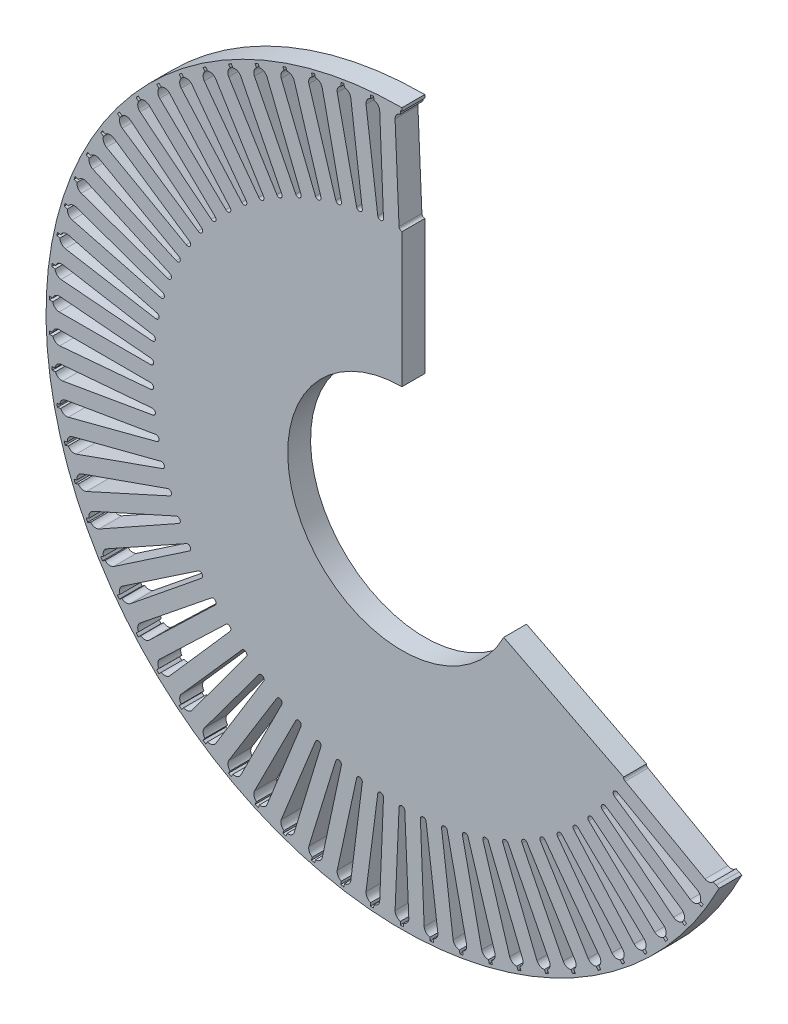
SolidWorks part; units mm, degrees
ref_plane "Přední rovina" through (0, 0, 0) normal (0, 0, 1) x (1, 0, 0)
ref_plane "Horní rovina" through (0, 0, 0) normal (0, 1, 0) x (1, 0, 0)
ref_plane "Pravá rovina" through (0, 0, 0) normal (1, 0, 0) x (0, 0, -1)
sketch "Skica2" plane through (0, 0, 0) normal (0, 0, 1) x (1, 0, 0)
  circle A0 centre (0, 0) radius 25
  circle A1 centre (0, 0) radius 77.9
extrude "Přidat vysunutím1" add sketch "Skica2" along normal blind 5
sketch "Skica1" plane through (0, 0, 0) normal (0, 0, 1) x (1, 0, 0)
  line L0 (0, 94.0554) -> (0, -97.5291) construction
  line L1 (-111.4898, 0) -> (131.9321, 0) construction
  line L2 (0, 77.9) -> (0, 77.2)
  line L3 (-0.35, 77.2) -> (0.35, 77.2)
  line L4 (0.35, 77.2) -> (0.35, 76.5)
  line L5 (0, 76.5) -> (0, 75.0365)
  line L6 (0, 75.0365) -> (0, 55.0346)
  line L7 (1.5047, 75.0365) -> (0.63, 55.0346)
  line L8 (-1.5047, 75.0365) -> (-0.63, 55.0346)
  line L9 (-0.35, 77.2) -> (-0.35, 76.5)
  line L10 (4.8642, 74.8938) -> (4.0395, 54.8898)
  line L11 (7.8629, 74.6386) -> (5.295, 54.7829)
  line L12 (6.8958, 76.8922) -> (6.8364, 76.1947)
  line L13 (6.1983, 76.9516) -> (6.1389, 76.2541)
  line L14 (6.1983, 76.9516) -> (6.8958, 76.8922)
  line L15 (11.1981, 74.2115) -> (8.68, 54.3495)
  line L16 (14.1643, 73.7029) -> (9.9218, 54.1365)
  line L17 (13.3918, 76.0304) -> (13.2735, 75.3405)
  line L18 (12.7019, 76.1487) -> (12.5836, 75.4588)
  line L19 (12.7019, 76.1487) -> (13.3918, 76.0304)
  line L20 (17.4514, 72.9945) -> (13.2578, 53.4176)
  line L21 (20.3637, 72.2362) -> (14.4772, 53.1001)
  line L22 (19.7914, 74.6208) -> (19.615, 73.9434)
  line L23 (19.114, 74.7972) -> (18.9376, 74.1198)
  line L24 (19.114, 74.7972) -> (19.7914, 74.6208)
  line L25 (23.5789, 71.2515) -> (17.7402, 52.1008)
  line L26 (26.4164, 70.249) -> (18.9282, 51.681)
  line L27 (26.0484, 72.6735) -> (25.8152, 72.0135)
  line L28 (25.3884, 72.9067) -> (25.1552, 72.2467)
  line L29 (25.3884, 72.9067) -> (26.0484, 72.6735)
  line L30 (29.5365, 68.9952) -> (22.0948, 50.4086)
  line L31 (32.2788, 67.7556) -> (23.2429, 49.8896)
  line L32 (32.1177, 70.2027) -> (31.8294, 69.5648)
  line L33 (31.4798, 70.491) -> (31.1915, 69.8531)
  line L34 (31.4798, 70.491) -> (32.1177, 70.2027)
  line L35 (35.2813, 66.2418) -> (26.2901, 48.3533)
  line L36 (37.9086, 64.7741) -> (27.3901, 47.7388)
  line L37 (37.9556, 67.226) -> (37.6142, 66.6149)
  line L38 (37.3445, 67.5674) -> (37.0031, 66.9563)
  line L39 (37.3445, 67.5674) -> (37.9556, 67.226)
  line L40 (40.7719, 63.0111) -> (30.296, 45.9495)
  line L41 (43.2653, 61.3259) -> (31.34, 45.2439)
  line L42 (43.52, 63.765) -> (43.128, 63.185)
  line L43 (42.9401, 64.1569) -> (42.5481, 63.577)
  line L44 (42.9401, 64.1569) -> (43.52, 63.765)
  line L45 (45.9687, 59.3264) -> (34.0837, 43.2147)
  line L46 (48.3102, 57.4358) -> (35.064, 42.4231)
  line L47 (48.7709, 59.8445) -> (48.3311, 59.2999)
  line L48 (48.2263, 60.2842) -> (47.7865, 59.7396)
  line L49 (48.2263, 60.2842) -> (48.7709, 59.8445)
  line L50 (50.8343, 55.2143) -> (37.6258, 40.1685)
  line L51 (53.007, 53.1319) -> (38.5354, 39.2967)
  line L52 (53.6704, 55.4928) -> (53.186, 54.9875)
  line L53 (53.165, 55.9772) -> (52.6806, 55.4718)
  line L54 (53.165, 55.9772) -> (53.6704, 55.4928)
  line L55 (55.3337, 50.7043) -> (40.8967, 36.8329)
  line L56 (57.322, 48.4452) -> (41.7292, 35.8871)
  line L57 (58.1831, 50.7414) -> (57.6577, 50.2789)
  line L58 (57.7207, 51.2668) -> (57.1952, 50.8044)
  line L59 (57.7207, 51.2668) -> (58.1831, 50.7414)
  line L60 (59.4344, 45.829) -> (43.8731, 33.2319)
  line L61 (61.2239, 43.4094) -> (44.6223, 32.2189)
  line L62 (62.2767, 45.6243) -> (61.7139, 45.208)
  line L63 (61.8605, 46.1871) -> (61.2977, 45.7708)
  line L64 (61.8605, 46.1871) -> (62.2767, 45.6243)
  line L65 (63.1068, 40.6235) -> (46.5333, 29.3915)
  line L66 (64.6847, 38.0609) -> (47.1939, 28.3186)
  line L67 (65.9216, 40.1785) -> (65.3255, 39.8115)
  line L68 (65.5545, 40.7746) -> (64.9585, 40.4075)
  line L69 (65.5545, 40.7746) -> (65.9216, 40.1785)
  line L70 (66.3246, 35.1253) -> (48.8582, 25.3393)
  line L71 (67.6795, 32.4381) -> (49.4255, 24.2143)
  line L72 (69.0914, 34.4432) -> (68.4664, 34.1281)
  line L73 (68.7763, 35.0683) -> (68.1513, 34.7531)
  line L74 (68.7763, 35.0683) -> (69.0914, 34.4432)
  line L75 (69.0645, 29.3741) -> (50.8311, 21.1046)
  line L76 (70.1866, 26.5816) -> (51.3009, 19.9354)
  line L77 (71.7635, 28.4598) -> (71.114, 28.1988)
  line L78 (71.5025, 29.1093) -> (70.853, 28.8483)
  line L79 (71.5025, 29.1093) -> (71.7635, 28.4598)
  line L80 (71.3068, 23.4112) -> (52.4378, 16.7178)
  line L81 (72.1881, 20.5336) -> (52.8068, 15.513)
  line L82 (73.9186, 22.2713) -> (73.2492, 22.0663)
  line L83 (73.7136, 22.9406) -> (73.0443, 22.7356)
  line L84 (73.7136, 22.9406) -> (73.9186, 22.2713)
  line L85 (73.0353, 17.2796) -> (53.6667, 12.2105)
  line L86 (73.6694, 14.3377) -> (53.9321, 10.9788)
  line L87 (75.541, 15.9223) -> (74.8567, 15.7748)
  line L88 (75.3935, 16.6066) -> (74.7092, 16.4591)
  line L89 (75.3935, 16.6066) -> (75.541, 15.9223)
  line L90 (74.2376, 11.0235) -> (54.5088, 7.6153)
  line L91 (74.6199, 8.0384) -> (54.6689, 6.3655)
  line L92 (76.6192, 9.4586) -> (75.9248, 9.3697)
  line L93 (76.5303, 10.1529) -> (75.8359, 10.064)
  line L94 (76.5303, 10.1529) -> (76.6192, 9.4586)
  line L95 (74.9051, 4.688) -> (54.9583, 2.9652)
  line L96 (75.0328, 1.6813) -> (55.0118, 1.7063)
  line L97 (77.1453, 2.9268) -> (76.4459, 2.8971)
  line L98 (77.1156, 3.6261) -> (76.4162, 3.5964)
  line L99 (77.1156, 3.6261) -> (77.1453, 2.9268)
  line L100 (75.0328, -1.6813) -> (55.0118, -1.7063)
  line L101 (74.9051, -4.688) -> (54.9583, -2.9652)
  line L102 (77.1156, -3.6261) -> (76.4162, -3.5964)
  line L103 (77.1453, -2.9268) -> (76.4459, -2.8971)
  line L104 (77.1453, -2.9268) -> (77.1156, -3.6261)
  line L105 (74.6199, -8.0384) -> (54.6689, -6.3655)
  line L106 (74.2376, -11.0235) -> (54.5088, -7.6153)
  line L107 (76.5303, -10.1529) -> (75.8359, -10.064)
  line L108 (76.6192, -9.4586) -> (75.9248, -9.3697)
  line L109 (76.6192, -9.4586) -> (76.5303, -10.1529)
  line L110 (73.6694, -14.3377) -> (53.9321, -10.9788)
  line L111 (73.0353, -17.2796) -> (53.6667, -12.2105)
  line L112 (75.3935, -16.6066) -> (74.7092, -16.4591)
  line L113 (75.541, -15.9223) -> (74.8567, -15.7748)
  line L114 (75.541, -15.9223) -> (75.3935, -16.6066)
  line L115 (72.1881, -20.5336) -> (52.8068, -15.513)
  line L116 (71.3068, -23.4112) -> (52.4378, -16.7178)
  line L117 (73.7136, -22.9406) -> (73.0443, -22.7356)
  line L118 (73.9186, -22.2713) -> (73.2492, -22.0663)
  line L119 (73.9186, -22.2713) -> (73.7136, -22.9406)
  line L120 (70.1866, -26.5816) -> (51.3009, -19.9354)
  line L121 (69.0645, -29.3741) -> (50.8311, -21.1046)
  line L122 (71.5025, -29.1093) -> (70.853, -28.8483)
  line L123 (71.7635, -28.4598) -> (71.114, -28.1988)
  line L124 (71.7635, -28.4598) -> (71.5025, -29.1093)
  line L125 (67.6795, -32.4381) -> (49.4255, -24.2143)
  line L126 (66.3246, -35.1253) -> (48.8582, -25.3393)
  line L127 (68.7763, -35.0683) -> (68.1513, -34.7531)
  line L128 (69.0914, -34.4432) -> (68.4664, -34.1281)
  line L129 (69.0914, -34.4432) -> (68.7763, -35.0683)
  line L130 (64.6847, -38.0609) -> (47.1939, -28.3186)
  line L131 (63.1068, -40.6235) -> (46.5333, -29.3915)
  line L132 (65.5545, -40.7746) -> (64.9585, -40.4075)
  line L133 (65.9216, -40.1785) -> (65.3255, -39.8115)
  line L134 (65.9216, -40.1785) -> (65.5545, -40.7746)
  line L135 (61.2239, -43.4094) -> (44.6223, -32.2189)
  line L136 (59.4344, -45.829) -> (43.8731, -33.2319)
  line L137 (61.8605, -46.1871) -> (61.2977, -45.7708)
  line L138 (62.2767, -45.6243) -> (61.7139, -45.208)
  line L139 (62.2767, -45.6243) -> (61.8605, -46.1871)
  line L140 (57.322, -48.4452) -> (41.7292, -35.8871)
  line L141 (55.3337, -50.7043) -> (40.8967, -36.8329)
  line L142 (57.7207, -51.2668) -> (57.1952, -50.8044)
  line L143 (58.1831, -50.7414) -> (57.6577, -50.2789)
  line L144 (58.1831, -50.7414) -> (57.7207, -51.2668)
  line L145 (53.007, -53.1319) -> (38.5354, -39.2967)
  line L146 (50.8343, -55.2143) -> (37.6258, -40.1685)
  line L147 (53.165, -55.9772) -> (52.6806, -55.4718)
  line L148 (53.6704, -55.4928) -> (53.186, -54.9875)
  line L149 (53.6704, -55.4928) -> (53.165, -55.9772)
  line L150 (48.3102, -57.4358) -> (35.064, -42.4231)
  line L151 (45.9687, -59.3264) -> (34.0837, -43.2147)
  line L152 (48.2263, -60.2842) -> (47.7865, -59.7396)
  line L153 (48.7709, -59.8445) -> (48.3311, -59.2999)
  line L154 (48.7709, -59.8445) -> (48.2263, -60.2842)
  line L155 (43.2653, -61.3259) -> (31.34, -45.2439)
  line L156 (40.7719, -63.0111) -> (30.296, -45.9495)
  line L157 (42.9401, -64.1569) -> (42.5481, -63.577)
  line L158 (43.52, -63.765) -> (43.128, -63.185)
  line L159 (43.52, -63.765) -> (42.9401, -64.1569)
  line L160 (37.9086, -64.7741) -> (27.3901, -47.7388)
  line L161 (35.2813, -66.2418) -> (26.2901, -48.3533)
  line L162 (37.3445, -67.5674) -> (37.0031, -66.9563)
  line L163 (37.9556, -67.226) -> (37.6142, -66.6149)
  line L164 (37.9556, -67.226) -> (37.3445, -67.5674)
  line L165 (32.2788, -67.7556) -> (23.2429, -49.8896)
  line L166 (29.5365, -68.9952) -> (22.0948, -50.4086)
  line L167 (31.4798, -70.491) -> (31.1915, -69.8531)
  line L168 (32.1177, -70.2027) -> (31.8294, -69.5648)
  line L169 (32.1177, -70.2027) -> (31.4798, -70.491)
  line L170 (26.4164, -70.249) -> (18.9282, -51.681)
  line L171 (23.5789, -71.2515) -> (17.7402, -52.1008)
  line L172 (25.3884, -72.9067) -> (25.1552, -72.2467)
  line L173 (26.0484, -72.6735) -> (25.8152, -72.0135)
  line L174 (26.0484, -72.6735) -> (25.3884, -72.9067)
  line L175 (20.3637, -72.2362) -> (14.4772, -53.1001)
  line L176 (17.4514, -72.9945) -> (13.2578, -53.4176)
  line L177 (19.114, -74.7972) -> (18.9376, -74.1198)
  line L178 (19.7914, -74.6208) -> (19.615, -73.9434)
  line L179 (19.7914, -74.6208) -> (19.114, -74.7972)
  line L180 (14.1643, -73.7029) -> (9.9218, -54.1365)
  line L181 (11.1981, -74.2115) -> (8.68, -54.3495)
  line L182 (12.7019, -76.1487) -> (12.5836, -75.4588)
  line L183 (13.3918, -76.0304) -> (13.2735, -75.3405)
  line L184 (13.3918, -76.0304) -> (12.7019, -76.1487)
  line L185 (7.8629, -74.6386) -> (5.295, -54.7829)
  line L186 (4.8642, -74.8938) -> (4.0395, -54.8898)
  line L187 (6.1983, -76.9516) -> (6.1389, -76.2541)
  line L188 (6.8958, -76.8922) -> (6.8364, -76.1947)
  line L189 (6.8958, -76.8922) -> (6.1983, -76.9516)
  line L190 (1.5047, -75.0365) -> (0.63, -55.0346)
  line L191 (-1.5047, -75.0365) -> (-0.63, -55.0346)
  line L192 (-0.35, -77.2) -> (-0.35, -76.5)
  line L193 (0.35, -77.2) -> (0.35, -76.5)
  line L194 (0.35, -77.2) -> (-0.35, -77.2)
  line L195 (-4.8642, -74.8938) -> (-4.0395, -54.8898)
  line L196 (-7.8629, -74.6386) -> (-5.295, -54.7829)
  line L197 (-6.8958, -76.8922) -> (-6.8364, -76.1947)
  line L198 (-6.1983, -76.9516) -> (-6.1389, -76.2541)
  line L199 (-6.1983, -76.9516) -> (-6.8958, -76.8922)
  line L200 (-11.1981, -74.2115) -> (-8.68, -54.3495)
  line L201 (-14.1643, -73.7029) -> (-9.9218, -54.1365)
  line L202 (-13.3918, -76.0304) -> (-13.2735, -75.3405)
  line L203 (-12.7019, -76.1487) -> (-12.5836, -75.4588)
  line L204 (-12.7019, -76.1487) -> (-13.3918, -76.0304)
  line L205 (-17.4514, -72.9945) -> (-13.2578, -53.4176)
  line L206 (-20.3637, -72.2362) -> (-14.4772, -53.1001)
  line L207 (-19.7914, -74.6208) -> (-19.615, -73.9434)
  line L208 (-19.114, -74.7972) -> (-18.9376, -74.1198)
  line L209 (-19.114, -74.7972) -> (-19.7914, -74.6208)
  line L210 (-23.5789, -71.2515) -> (-17.7402, -52.1008)
  line L211 (-26.4164, -70.249) -> (-18.9282, -51.681)
  line L212 (-26.0484, -72.6735) -> (-25.8152, -72.0135)
  line L213 (-25.3884, -72.9067) -> (-25.1552, -72.2467)
  line L214 (-25.3884, -72.9067) -> (-26.0484, -72.6735)
  line L215 (-29.5365, -68.9952) -> (-22.0948, -50.4086)
  line L216 (-32.2788, -67.7556) -> (-23.2429, -49.8896)
  line L217 (-32.1177, -70.2027) -> (-31.8294, -69.5648)
  line L218 (-31.4798, -70.491) -> (-31.1915, -69.8531)
  line L219 (-31.4798, -70.491) -> (-32.1177, -70.2027)
  line L220 (-35.2813, -66.2418) -> (-26.2901, -48.3533)
  line L221 (-37.9086, -64.7741) -> (-27.3901, -47.7388)
  line L222 (-37.9556, -67.226) -> (-37.6142, -66.6149)
  line L223 (-37.3445, -67.5674) -> (-37.0031, -66.9563)
  line L224 (-37.3445, -67.5674) -> (-37.9556, -67.226)
  line L225 (-40.7719, -63.0111) -> (-30.296, -45.9495)
  line L226 (-43.2653, -61.3259) -> (-31.34, -45.2439)
  line L227 (-43.52, -63.765) -> (-43.128, -63.185)
  line L228 (-42.9401, -64.1569) -> (-42.5481, -63.577)
  line L229 (-42.9401, -64.1569) -> (-43.52, -63.765)
  line L230 (-45.9687, -59.3264) -> (-34.0837, -43.2147)
  line L231 (-48.3102, -57.4358) -> (-35.064, -42.4231)
  line L232 (-48.7709, -59.8445) -> (-48.3311, -59.2999)
  line L233 (-48.2263, -60.2842) -> (-47.7865, -59.7396)
  line L234 (-48.2263, -60.2842) -> (-48.7709, -59.8445)
  line L235 (-50.8343, -55.2143) -> (-37.6258, -40.1685)
  line L236 (-53.007, -53.1319) -> (-38.5354, -39.2967)
  line L237 (-53.6704, -55.4928) -> (-53.186, -54.9875)
  line L238 (-53.165, -55.9772) -> (-52.6806, -55.4718)
  line L239 (-53.165, -55.9772) -> (-53.6704, -55.4928)
  line L240 (-55.3337, -50.7043) -> (-40.8967, -36.8329)
  line L241 (-57.322, -48.4452) -> (-41.7292, -35.8871)
  line L242 (-58.1831, -50.7414) -> (-57.6577, -50.2789)
  line L243 (-57.7207, -51.2668) -> (-57.1952, -50.8044)
  line L244 (-57.7207, -51.2668) -> (-58.1831, -50.7414)
  line L245 (-59.4344, -45.829) -> (-43.8731, -33.2319)
  line L246 (-61.2239, -43.4094) -> (-44.6223, -32.2189)
  line L247 (-62.2767, -45.6243) -> (-61.7139, -45.208)
  line L248 (-61.8605, -46.1871) -> (-61.2977, -45.7708)
  line L249 (-61.8605, -46.1871) -> (-62.2767, -45.6243)
  line L250 (-63.1068, -40.6235) -> (-46.5333, -29.3915)
  line L251 (-64.6847, -38.0609) -> (-47.1939, -28.3186)
  line L252 (-65.9216, -40.1785) -> (-65.3255, -39.8115)
  line L253 (-65.5545, -40.7746) -> (-64.9585, -40.4075)
  line L254 (-65.5545, -40.7746) -> (-65.9216, -40.1785)
  line L255 (-66.3246, -35.1253) -> (-48.8582, -25.3393)
  line L256 (-67.6795, -32.4381) -> (-49.4255, -24.2143)
  line L257 (-69.0914, -34.4432) -> (-68.4664, -34.1281)
  line L258 (-68.7763, -35.0683) -> (-68.1513, -34.7531)
  line L259 (-68.7763, -35.0683) -> (-69.0914, -34.4432)
  line L260 (-69.0645, -29.3741) -> (-50.8311, -21.1046)
  line L261 (-70.1866, -26.5816) -> (-51.3009, -19.9354)
  line L262 (-71.7635, -28.4598) -> (-71.114, -28.1988)
  line L263 (-71.5025, -29.1093) -> (-70.853, -28.8483)
  line L264 (-71.5025, -29.1093) -> (-71.7635, -28.4598)
  line L265 (-71.3068, -23.4112) -> (-52.4378, -16.7178)
  line L266 (-72.1881, -20.5336) -> (-52.8068, -15.513)
  line L267 (-73.9186, -22.2713) -> (-73.2492, -22.0663)
  line L268 (-73.7136, -22.9406) -> (-73.0443, -22.7356)
  line L269 (-73.7136, -22.9406) -> (-73.9186, -22.2713)
  line L270 (-73.0353, -17.2796) -> (-53.6667, -12.2105)
  line L271 (-73.6694, -14.3377) -> (-53.9321, -10.9788)
  line L272 (-75.541, -15.9223) -> (-74.8567, -15.7748)
  line L273 (-75.3935, -16.6066) -> (-74.7092, -16.4591)
  line L274 (-75.3935, -16.6066) -> (-75.541, -15.9223)
  line L275 (-74.2376, -11.0235) -> (-54.5088, -7.6153)
  line L276 (-74.6199, -8.0384) -> (-54.6689, -6.3655)
  line L277 (-76.6192, -9.4586) -> (-75.9248, -9.3697)
  line L278 (-76.5303, -10.1529) -> (-75.8359, -10.064)
  line L279 (-76.5303, -10.1529) -> (-76.6192, -9.4586)
  line L280 (-74.9051, -4.688) -> (-54.9583, -2.9652)
  line L281 (-75.0328, -1.6813) -> (-55.0118, -1.7063)
  line L282 (-77.1453, -2.9268) -> (-76.4459, -2.8971)
  line L283 (-77.1156, -3.6261) -> (-76.4162, -3.5964)
  line L284 (-77.1156, -3.6261) -> (-77.1453, -2.9268)
  line L285 (-75.0328, 1.6813) -> (-55.0118, 1.7063)
  line L286 (-74.9051, 4.688) -> (-54.9583, 2.9652)
  line L287 (-77.1156, 3.6261) -> (-76.4162, 3.5964)
  line L288 (-77.1453, 2.9268) -> (-76.4459, 2.8971)
  line L289 (-77.1453, 2.9268) -> (-77.1156, 3.6261)
  line L290 (-74.6199, 8.0384) -> (-54.6689, 6.3655)
  line L291 (-74.2376, 11.0235) -> (-54.5088, 7.6153)
  line L292 (-76.5303, 10.1529) -> (-75.8359, 10.064)
  line L293 (-76.6192, 9.4586) -> (-75.9248, 9.3697)
  line L294 (-76.6192, 9.4586) -> (-76.5303, 10.1529)
  line L295 (-73.6694, 14.3377) -> (-53.9321, 10.9788)
  line L296 (-73.0353, 17.2796) -> (-53.6667, 12.2105)
  line L297 (-75.3935, 16.6066) -> (-74.7092, 16.4591)
  line L298 (-75.541, 15.9223) -> (-74.8567, 15.7748)
  line L299 (-75.541, 15.9223) -> (-75.3935, 16.6066)
  line L300 (-72.1881, 20.5336) -> (-52.8068, 15.513)
  line L301 (-71.3068, 23.4112) -> (-52.4378, 16.7178)
  line L302 (-73.7136, 22.9406) -> (-73.0443, 22.7356)
  line L303 (-73.9186, 22.2713) -> (-73.2492, 22.0663)
  line L304 (-73.9186, 22.2713) -> (-73.7136, 22.9406)
  line L305 (-70.1866, 26.5816) -> (-51.3009, 19.9354)
  line L306 (-69.0645, 29.3741) -> (-50.8311, 21.1046)
  line L307 (-71.5025, 29.1093) -> (-70.853, 28.8483)
  line L308 (-71.7635, 28.4598) -> (-71.114, 28.1988)
  line L309 (-71.7635, 28.4598) -> (-71.5025, 29.1093)
  line L310 (-67.6795, 32.4381) -> (-49.4255, 24.2143)
  line L311 (-66.3246, 35.1253) -> (-48.8582, 25.3393)
  line L312 (-68.7763, 35.0683) -> (-68.1513, 34.7531)
  line L313 (-69.0914, 34.4432) -> (-68.4664, 34.1281)
  line L314 (-69.0914, 34.4432) -> (-68.7763, 35.0683)
  line L315 (-64.6847, 38.0609) -> (-47.1939, 28.3186)
  line L316 (-63.1068, 40.6235) -> (-46.5333, 29.3915)
  line L317 (-65.5545, 40.7746) -> (-64.9585, 40.4075)
  line L318 (-65.9216, 40.1785) -> (-65.3255, 39.8115)
  line L319 (-65.9216, 40.1785) -> (-65.5545, 40.7746)
  line L320 (-61.2239, 43.4094) -> (-44.6223, 32.2189)
  line L321 (-59.4344, 45.829) -> (-43.8731, 33.2319)
  line L322 (-61.8605, 46.1871) -> (-61.2977, 45.7708)
  line L323 (-62.2767, 45.6243) -> (-61.7139, 45.208)
  line L324 (-62.2767, 45.6243) -> (-61.8605, 46.1871)
  line L325 (-57.322, 48.4452) -> (-41.7292, 35.8871)
  line L326 (-55.3337, 50.7043) -> (-40.8967, 36.8329)
  line L327 (-57.7207, 51.2668) -> (-57.1952, 50.8044)
  line L328 (-58.1831, 50.7414) -> (-57.6577, 50.2789)
  line L329 (-58.1831, 50.7414) -> (-57.7207, 51.2668)
  line L330 (-53.007, 53.1319) -> (-38.5354, 39.2967)
  line L331 (-50.8343, 55.2143) -> (-37.6258, 40.1685)
  line L332 (-53.165, 55.9772) -> (-52.6806, 55.4718)
  line L333 (-53.6704, 55.4928) -> (-53.186, 54.9875)
  line L334 (-53.6704, 55.4928) -> (-53.165, 55.9772)
  line L335 (-48.3102, 57.4358) -> (-35.064, 42.4231)
  line L336 (-45.9687, 59.3264) -> (-34.0837, 43.2147)
  line L337 (-48.2263, 60.2842) -> (-47.7865, 59.7396)
  line L338 (-48.7709, 59.8445) -> (-48.3311, 59.2999)
  line L339 (-48.7709, 59.8445) -> (-48.2263, 60.2842)
  line L340 (-43.2653, 61.3259) -> (-31.34, 45.2439)
  line L341 (-40.7719, 63.0111) -> (-30.296, 45.9495)
  line L342 (-42.9401, 64.1569) -> (-42.5481, 63.577)
  line L343 (-43.52, 63.765) -> (-43.128, 63.185)
  line L344 (-43.52, 63.765) -> (-42.9401, 64.1569)
  line L345 (-37.9086, 64.7741) -> (-27.3901, 47.7388)
  line L346 (-35.2813, 66.2418) -> (-26.2901, 48.3533)
  line L347 (-37.3445, 67.5674) -> (-37.0031, 66.9563)
  line L348 (-37.9556, 67.226) -> (-37.6142, 66.6149)
  line L349 (-37.9556, 67.226) -> (-37.3445, 67.5674)
  line L350 (-32.2788, 67.7556) -> (-23.2429, 49.8896)
  line L351 (-29.5365, 68.9952) -> (-22.0948, 50.4086)
  line L352 (-31.4798, 70.491) -> (-31.1915, 69.8531)
  line L353 (-32.1177, 70.2027) -> (-31.8294, 69.5648)
  line L354 (-32.1177, 70.2027) -> (-31.4798, 70.491)
  line L355 (-26.4164, 70.249) -> (-18.9282, 51.681)
  line L356 (-23.5789, 71.2515) -> (-17.7402, 52.1008)
  line L357 (-25.3884, 72.9067) -> (-25.1552, 72.2467)
  line L358 (-26.0484, 72.6735) -> (-25.8152, 72.0135)
  line L359 (-26.0484, 72.6735) -> (-25.3884, 72.9067)
  line L360 (-20.3637, 72.2362) -> (-14.4772, 53.1001)
  line L361 (-17.4514, 72.9945) -> (-13.2578, 53.4176)
  line L362 (-19.114, 74.7972) -> (-18.9376, 74.1198)
  line L363 (-19.7914, 74.6208) -> (-19.615, 73.9434)
  line L364 (-19.7914, 74.6208) -> (-19.114, 74.7972)
  line L365 (-14.1643, 73.7029) -> (-9.9218, 54.1365)
  line L366 (-11.1981, 74.2115) -> (-8.68, 54.3495)
  line L367 (-12.7019, 76.1487) -> (-12.5836, 75.4588)
  line L368 (-13.3918, 76.0304) -> (-13.2735, 75.3405)
  line L369 (-13.3918, 76.0304) -> (-12.7019, 76.1487)
  line L370 (-7.8629, 74.6386) -> (-5.295, 54.7829)
  line L371 (-4.8642, 74.8938) -> (-4.0395, 54.8898)
  line L372 (-6.1983, 76.9516) -> (-6.1389, 76.2541)
  line L373 (-6.8958, 76.8922) -> (-6.8364, 76.1947)
  line L374 (-6.8958, 76.8922) -> (-6.1983, 76.9516)
  circle A0 centre (0, 0) radius 25
  circle A1 centre (0, 0) radius 77.9
  arc A2 (1.499, 74.9052) -> (0.35, 76.5) centre (0, 75.0365) ccw
  arc A3 (-0.63, 55.0346) -> (0.63, 55.0346) centre (0, 55.0346) ccw
  arc A4 (-0.35, 76.5) -> (-1.499, 74.9052) centre (0, 75.0365) ccw
  arc A5 (4.0395, 54.8898) -> (5.295, 54.7829) centre (4.6673, 54.8364) ccw
  arc A6 (6.1389, 76.2541) -> (4.8588, 74.7624) centre (6.3635, 74.7662) ccw
  arc A7 (7.846, 74.5082) -> (6.8364, 76.1947) centre (6.3635, 74.7662) ccw
  arc A8 (8.68, 54.3495) -> (9.9218, 54.1365) centre (9.3009, 54.243) ccw
  arc A9 (12.5836, 75.4588) -> (11.1816, 74.0811) centre (12.6812, 73.9572) ccw
  arc A10 (14.1365, 73.5744) -> (13.2735, 75.3405) centre (12.6812, 73.9572) ccw
  arc A11 (13.2578, 53.4176) -> (14.4772, 53.1001) centre (13.8675, 53.2588) ccw
  arc A12 (18.9376, 74.1198) -> (17.4238, 72.8659) centre (18.9076, 72.6153) ccw
  arc A13 (20.3251, 72.1105) -> (19.615, 73.9434) centre (18.9076, 72.6153) ccw
  arc A14 (17.7402, 52.1008) -> (18.9282, 51.681) centre (18.3342, 51.8909) ccw
  arc A15 (25.1552, 72.2467) -> (23.5405, 71.1258) centre (24.9977, 70.7503) ccw
  arc A16 (26.3673, 70.127) -> (25.8152, 72.0135) centre (24.9977, 70.7503) ccw
  arc A17 (22.0948, 50.4086) -> (23.2429, 49.8896) centre (22.6688, 50.1491) ccw
  arc A18 (31.1915, 69.8531) -> (29.4876, 68.8732) centre (30.9076, 68.3754) ccw
  arc A19 (32.2195, 67.6383) -> (31.8294, 69.5648) centre (30.9076, 68.3754) ccw
  arc A20 (26.2901, 48.3533) -> (27.3901, 47.7388) centre (26.8401, 48.046) ccw
  arc A21 (37.0031, 66.9563) -> (35.2222, 66.1243) centre (36.5949, 65.508) ccw
  arc A22 (37.8395, 64.6622) -> (37.6142, 66.6149) centre (36.5949, 65.508) ccw
  arc A23 (30.296, 45.9495) -> (31.34, 45.2439) centre (30.818, 45.5967) ccw
  arc A24 (42.5481, 63.577) -> (40.7031, 62.8991) centre (42.0186, 62.1685) ccw
  arc A25 (43.1869, 61.2203) -> (43.128, 63.185) centre (42.0186, 62.1685) ccw
  arc A26 (34.0837, 43.2147) -> (35.064, 42.4231) centre (34.5739, 42.8189) ccw
  arc A27 (47.7865, 59.7396) -> (45.8907, 59.2206) centre (47.1394, 58.3811) ccw
  arc A28 (48.2232, 57.3372) -> (48.3311, 59.2999) centre (47.1394, 58.3811) ccw
  arc A29 (37.6258, 40.1685) -> (38.5354, 39.2967) centre (38.0806, 39.7326) ccw
  arc A30 (52.6806, 55.4718) -> (50.7476, 55.1155) centre (51.9207, 54.1731) ccw
  arc A31 (52.912, 53.041) -> (53.186, 54.9875) centre (51.9207, 54.1731) ccw
  arc A32 (40.8967, 36.8329) -> (41.7292, 35.8871) centre (41.313, 36.36) ccw
  arc A33 (57.1952, 50.8044) -> (55.2389, 50.6132) centre (56.3278, 49.5747) ccw
  arc A34 (57.2196, 48.3627) -> (57.6577, 50.2789) centre (56.3278, 49.5747) ccw
  arc A35 (43.8731, 33.2319) -> (44.6223, 32.2189) centre (44.2477, 32.7254) ccw
  arc A36 (61.2977, 45.7708) -> (59.3322, 45.7463) centre (60.3292, 44.6192) ccw
  arc A37 (61.1149, 43.3359) -> (61.7139, 45.208) centre (60.3292, 44.6192) ccw
  arc A38 (46.5333, 29.3915) -> (47.1939, 28.3186) centre (46.8636, 28.8551) ccw
  arc A39 (64.9585, 40.4075) -> (62.998, 40.5498) centre (63.8958, 39.3422) ccw
  arc A40 (64.5699, 37.9969) -> (65.3255, 39.8115) centre (63.8958, 39.3422) ccw
  arc A41 (48.8582, 25.3393) -> (49.4255, 24.2143) centre (49.1418, 24.7768) ccw
  arc A42 (68.1513, 34.7531) -> (66.2099, 35.0611) centre (67.0021, 33.7817) ccw
  arc A43 (67.5596, 32.3841) -> (68.4664, 34.1281) centre (67.0021, 33.7817) ccw
  arc A44 (50.8311, 21.1046) -> (51.3009, 19.9354) centre (51.066, 20.52) ccw
  arc A45 (70.853, 28.8483) -> (68.9448, 29.3198) centre (69.6256, 27.9779) ccw
  arc A46 (70.0626, 26.538) -> (71.114, 28.1988) centre (69.6256, 27.9779) ccw
  arc A47 (52.4378, 16.7178) -> (52.8068, 15.513) centre (52.6223, 16.1154) ccw
  arc A48 (73.0443, 22.7356) -> (71.1829, 23.3672) centre (71.7474, 21.9724) ccw
  arc A49 (72.0608, 20.5007) -> (73.2492, 22.0663) centre (71.7474, 21.9724) ccw
  arc A50 (53.6667, 12.2105) -> (53.9321, 10.9788) centre (53.7994, 11.5947) ccw
  arc A51 (74.7092, 16.4591) -> (72.9081, 17.2463) centre (73.3524, 15.8086) ccw
  arc A52 (73.5397, 14.3156) -> (74.8567, 15.7748) centre (73.3524, 15.8086) ccw
  arc A53 (54.5088, 7.6153) -> (54.6689, 6.3655) centre (54.5889, 6.9904) ccw
  arc A54 (75.8359, 10.064) -> (74.1081, 11.0011) centre (74.4288, 9.531) ccw
  arc A55 (74.4889, 8.0274) -> (75.9248, 9.3697) centre (74.4288, 9.531) ccw
  arc A56 (54.9583, 2.9652) -> (55.0118, 1.7063) centre (54.985, 2.3357) ccw
  arc A57 (76.4162, 3.5964) -> (74.7741, 4.6767) centre (74.9689, 3.1846) ccw
  arc A58 (74.9013, 1.6814) -> (76.4459, 2.8971) centre (74.9689, 3.1846) ccw
  arc A59 (55.0118, -1.7063) -> (54.9583, -2.9652) centre (54.985, -2.3357) ccw
  arc A60 (76.4459, -2.8971) -> (74.9013, -1.6814) centre (74.9689, -3.1846) ccw
  arc A61 (74.7741, -4.6767) -> (76.4162, -3.5964) centre (74.9689, -3.1846) ccw
  arc A62 (54.6689, -6.3655) -> (54.5088, -7.6153) centre (54.5889, -6.9904) ccw
  arc A63 (75.9248, -9.3697) -> (74.4889, -8.0274) centre (74.4288, -9.531) ccw
  arc A64 (74.1081, -11.0011) -> (75.8359, -10.064) centre (74.4288, -9.531) ccw
  arc A65 (53.9321, -10.9788) -> (53.6667, -12.2105) centre (53.7994, -11.5947) ccw
  arc A66 (74.8567, -15.7748) -> (73.5397, -14.3156) centre (73.3524, -15.8086) ccw
  arc A67 (72.9081, -17.2463) -> (74.7092, -16.4591) centre (73.3524, -15.8086) ccw
  arc A68 (52.8068, -15.513) -> (52.4378, -16.7178) centre (52.6223, -16.1154) ccw
  arc A69 (73.2492, -22.0663) -> (72.0608, -20.5007) centre (71.7474, -21.9724) ccw
  arc A70 (71.1829, -23.3672) -> (73.0443, -22.7356) centre (71.7474, -21.9724) ccw
  arc A71 (51.3009, -19.9354) -> (50.8311, -21.1046) centre (51.066, -20.52) ccw
  arc A72 (71.114, -28.1988) -> (70.0626, -26.538) centre (69.6256, -27.9779) ccw
  arc A73 (68.9448, -29.3198) -> (70.853, -28.8483) centre (69.6256, -27.9779) ccw
  arc A74 (49.4255, -24.2143) -> (48.8582, -25.3393) centre (49.1418, -24.7768) ccw
  arc A75 (68.4664, -34.1281) -> (67.5596, -32.3841) centre (67.0021, -33.7817) ccw
  arc A76 (66.2099, -35.0611) -> (68.1513, -34.7531) centre (67.0021, -33.7817) ccw
  arc A77 (47.1939, -28.3186) -> (46.5333, -29.3915) centre (46.8636, -28.8551) ccw
  arc A78 (65.3255, -39.8115) -> (64.5699, -37.9969) centre (63.8958, -39.3422) ccw
  arc A79 (62.998, -40.5498) -> (64.9585, -40.4075) centre (63.8958, -39.3422) ccw
  arc A80 (44.6223, -32.2189) -> (43.8731, -33.2319) centre (44.2477, -32.7254) ccw
  arc A81 (61.7139, -45.208) -> (61.1149, -43.3359) centre (60.3292, -44.6192) ccw
  arc A82 (59.3322, -45.7463) -> (61.2977, -45.7708) centre (60.3292, -44.6192) ccw
  arc A83 (41.7292, -35.8871) -> (40.8967, -36.8329) centre (41.313, -36.36) ccw
  arc A84 (57.6577, -50.2789) -> (57.2196, -48.3627) centre (56.3278, -49.5747) ccw
  arc A85 (55.2389, -50.6132) -> (57.1952, -50.8044) centre (56.3278, -49.5747) ccw
  arc A86 (38.5354, -39.2967) -> (37.6258, -40.1685) centre (38.0806, -39.7326) ccw
  arc A87 (53.186, -54.9875) -> (52.912, -53.041) centre (51.9207, -54.1731) ccw
  arc A88 (50.7476, -55.1155) -> (52.6806, -55.4718) centre (51.9207, -54.1731) ccw
  arc A89 (35.064, -42.4231) -> (34.0837, -43.2147) centre (34.5739, -42.8189) ccw
  arc A90 (48.3311, -59.2999) -> (48.2232, -57.3372) centre (47.1394, -58.3811) ccw
  arc A91 (45.8907, -59.2206) -> (47.7865, -59.7396) centre (47.1394, -58.3811) ccw
  arc A92 (31.34, -45.2439) -> (30.296, -45.9495) centre (30.818, -45.5967) ccw
  arc A93 (43.128, -63.185) -> (43.1869, -61.2203) centre (42.0186, -62.1685) ccw
  arc A94 (40.7031, -62.8991) -> (42.5481, -63.577) centre (42.0186, -62.1685) ccw
  arc A95 (27.3901, -47.7388) -> (26.2901, -48.3533) centre (26.8401, -48.046) ccw
  arc A96 (37.6142, -66.6149) -> (37.8395, -64.6622) centre (36.5949, -65.508) ccw
  arc A97 (35.2222, -66.1243) -> (37.0031, -66.9563) centre (36.5949, -65.508) ccw
  arc A98 (23.2429, -49.8896) -> (22.0948, -50.4086) centre (22.6688, -50.1491) ccw
  arc A99 (31.8294, -69.5648) -> (32.2195, -67.6383) centre (30.9076, -68.3754) ccw
  arc A100 (29.4876, -68.8732) -> (31.1915, -69.8531) centre (30.9076, -68.3754) ccw
  arc A101 (18.9282, -51.681) -> (17.7402, -52.1008) centre (18.3342, -51.8909) ccw
  arc A102 (25.8152, -72.0135) -> (26.3673, -70.127) centre (24.9977, -70.7503) ccw
  arc A103 (23.5405, -71.1258) -> (25.1552, -72.2467) centre (24.9977, -70.7503) ccw
  arc A104 (14.4772, -53.1001) -> (13.2578, -53.4176) centre (13.8675, -53.2588) ccw
  arc A105 (19.615, -73.9434) -> (20.3251, -72.1105) centre (18.9076, -72.6153) ccw
  arc A106 (17.4238, -72.8659) -> (18.9376, -74.1198) centre (18.9076, -72.6153) ccw
  arc A107 (9.9218, -54.1365) -> (8.68, -54.3495) centre (9.3009, -54.243) ccw
  arc A108 (13.2735, -75.3405) -> (14.1365, -73.5744) centre (12.6812, -73.9572) ccw
  arc A109 (11.1816, -74.0811) -> (12.5836, -75.4588) centre (12.6812, -73.9572) ccw
  arc A110 (5.295, -54.7829) -> (4.0395, -54.8898) centre (4.6673, -54.8364) ccw
  arc A111 (6.8364, -76.1947) -> (7.846, -74.5082) centre (6.3635, -74.7662) ccw
  arc A112 (4.8588, -74.7624) -> (6.1389, -76.2541) centre (6.3635, -74.7662) ccw
  arc A113 (0.63, -55.0346) -> (-0.63, -55.0346) centre (0, -55.0346) ccw
  arc A114 (0.35, -76.5) -> (1.499, -74.9052) centre (0, -75.0365) ccw
  arc A115 (-1.499, -74.9052) -> (-0.35, -76.5) centre (0, -75.0365) ccw
  arc A116 (-4.0395, -54.8898) -> (-5.295, -54.7829) centre (-4.6673, -54.8364) ccw
  arc A117 (-6.1389, -76.2541) -> (-4.8588, -74.7624) centre (-6.3635, -74.7662) ccw
  arc A118 (-7.846, -74.5082) -> (-6.8364, -76.1947) centre (-6.3635, -74.7662) ccw
  arc A119 (-8.68, -54.3495) -> (-9.9218, -54.1365) centre (-9.3009, -54.243) ccw
  arc A120 (-12.5836, -75.4588) -> (-11.1816, -74.0811) centre (-12.6812, -73.9572) ccw
  arc A121 (-14.1365, -73.5744) -> (-13.2735, -75.3405) centre (-12.6812, -73.9572) ccw
  arc A122 (-13.2578, -53.4176) -> (-14.4772, -53.1001) centre (-13.8675, -53.2588) ccw
  arc A123 (-18.9376, -74.1198) -> (-17.4238, -72.8659) centre (-18.9076, -72.6153) ccw
  arc A124 (-20.3251, -72.1105) -> (-19.615, -73.9434) centre (-18.9076, -72.6153) ccw
  arc A125 (-17.7402, -52.1008) -> (-18.9282, -51.681) centre (-18.3342, -51.8909) ccw
  arc A126 (-25.1552, -72.2467) -> (-23.5405, -71.1258) centre (-24.9977, -70.7503) ccw
  arc A127 (-26.3673, -70.127) -> (-25.8152, -72.0135) centre (-24.9977, -70.7503) ccw
  arc A128 (-22.0948, -50.4086) -> (-23.2429, -49.8896) centre (-22.6688, -50.1491) ccw
  arc A129 (-31.1915, -69.8531) -> (-29.4876, -68.8732) centre (-30.9076, -68.3754) ccw
  arc A130 (-32.2195, -67.6383) -> (-31.8294, -69.5648) centre (-30.9076, -68.3754) ccw
  arc A131 (-26.2901, -48.3533) -> (-27.3901, -47.7388) centre (-26.8401, -48.046) ccw
  arc A132 (-37.0031, -66.9563) -> (-35.2222, -66.1243) centre (-36.5949, -65.508) ccw
  arc A133 (-37.8395, -64.6622) -> (-37.6142, -66.6149) centre (-36.5949, -65.508) ccw
  arc A134 (-30.296, -45.9495) -> (-31.34, -45.2439) centre (-30.818, -45.5967) ccw
  arc A135 (-42.5481, -63.577) -> (-40.7031, -62.8991) centre (-42.0186, -62.1685) ccw
  arc A136 (-43.1869, -61.2203) -> (-43.128, -63.185) centre (-42.0186, -62.1685) ccw
  arc A137 (-34.0837, -43.2147) -> (-35.064, -42.4231) centre (-34.5739, -42.8189) ccw
  arc A138 (-47.7865, -59.7396) -> (-45.8907, -59.2206) centre (-47.1394, -58.3811) ccw
  arc A139 (-48.2232, -57.3372) -> (-48.3311, -59.2999) centre (-47.1394, -58.3811) ccw
  arc A140 (-37.6258, -40.1685) -> (-38.5354, -39.2967) centre (-38.0806, -39.7326) ccw
  arc A141 (-52.6806, -55.4718) -> (-50.7476, -55.1155) centre (-51.9207, -54.1731) ccw
  arc A142 (-52.912, -53.041) -> (-53.186, -54.9875) centre (-51.9207, -54.1731) ccw
  arc A143 (-40.8967, -36.8329) -> (-41.7292, -35.8871) centre (-41.313, -36.36) ccw
  arc A144 (-57.1952, -50.8044) -> (-55.2389, -50.6132) centre (-56.3278, -49.5747) ccw
  arc A145 (-57.2196, -48.3627) -> (-57.6577, -50.2789) centre (-56.3278, -49.5747) ccw
  arc A146 (-43.8731, -33.2319) -> (-44.6223, -32.2189) centre (-44.2477, -32.7254) ccw
  arc A147 (-61.2977, -45.7708) -> (-59.3322, -45.7463) centre (-60.3292, -44.6192) ccw
  arc A148 (-61.1149, -43.3359) -> (-61.7139, -45.208) centre (-60.3292, -44.6192) ccw
  arc A149 (-46.5333, -29.3915) -> (-47.1939, -28.3186) centre (-46.8636, -28.8551) ccw
  arc A150 (-64.9585, -40.4075) -> (-62.998, -40.5498) centre (-63.8958, -39.3422) ccw
  arc A151 (-64.5699, -37.9969) -> (-65.3255, -39.8115) centre (-63.8958, -39.3422) ccw
  arc A152 (-48.8582, -25.3393) -> (-49.4255, -24.2143) centre (-49.1418, -24.7768) ccw
  arc A153 (-68.1513, -34.7531) -> (-66.2099, -35.0611) centre (-67.0021, -33.7817) ccw
  arc A154 (-67.5596, -32.3841) -> (-68.4664, -34.1281) centre (-67.0021, -33.7817) ccw
  arc A155 (-50.8311, -21.1046) -> (-51.3009, -19.9354) centre (-51.066, -20.52) ccw
  arc A156 (-70.853, -28.8483) -> (-68.9448, -29.3198) centre (-69.6256, -27.9779) ccw
  arc A157 (-70.0626, -26.538) -> (-71.114, -28.1988) centre (-69.6256, -27.9779) ccw
  arc A158 (-52.4378, -16.7178) -> (-52.8068, -15.513) centre (-52.6223, -16.1154) ccw
  arc A159 (-73.0443, -22.7356) -> (-71.1829, -23.3672) centre (-71.7474, -21.9724) ccw
  arc A160 (-72.0608, -20.5007) -> (-73.2492, -22.0663) centre (-71.7474, -21.9724) ccw
  arc A161 (-53.6667, -12.2105) -> (-53.9321, -10.9788) centre (-53.7994, -11.5947) ccw
  arc A162 (-74.7092, -16.4591) -> (-72.9081, -17.2463) centre (-73.3524, -15.8086) ccw
  arc A163 (-73.5397, -14.3156) -> (-74.8567, -15.7748) centre (-73.3524, -15.8086) ccw
  arc A164 (-54.5088, -7.6153) -> (-54.6689, -6.3655) centre (-54.5889, -6.9904) ccw
  arc A165 (-75.8359, -10.064) -> (-74.1081, -11.0011) centre (-74.4288, -9.531) ccw
  arc A166 (-74.4889, -8.0274) -> (-75.9248, -9.3697) centre (-74.4288, -9.531) ccw
  arc A167 (-54.9583, -2.9652) -> (-55.0118, -1.7063) centre (-54.985, -2.3357) ccw
  arc A168 (-76.4162, -3.5964) -> (-74.7741, -4.6767) centre (-74.9689, -3.1846) ccw
  arc A169 (-74.9013, -1.6814) -> (-76.4459, -2.8971) centre (-74.9689, -3.1846) ccw
  arc A170 (-55.0118, 1.7063) -> (-54.9583, 2.9652) centre (-54.985, 2.3357) ccw
  arc A171 (-76.4459, 2.8971) -> (-74.9013, 1.6814) centre (-74.9689, 3.1846) ccw
  arc A172 (-74.7741, 4.6767) -> (-76.4162, 3.5964) centre (-74.9689, 3.1846) ccw
  arc A173 (-54.6689, 6.3655) -> (-54.5088, 7.6153) centre (-54.5889, 6.9904) ccw
  arc A174 (-75.9248, 9.3697) -> (-74.4889, 8.0274) centre (-74.4288, 9.531) ccw
  arc A175 (-74.1081, 11.0011) -> (-75.8359, 10.064) centre (-74.4288, 9.531) ccw
  arc A176 (-53.9321, 10.9788) -> (-53.6667, 12.2105) centre (-53.7994, 11.5947) ccw
  arc A177 (-74.8567, 15.7748) -> (-73.5397, 14.3156) centre (-73.3524, 15.8086) ccw
  arc A178 (-72.9081, 17.2463) -> (-74.7092, 16.4591) centre (-73.3524, 15.8086) ccw
  arc A179 (-52.8068, 15.513) -> (-52.4378, 16.7178) centre (-52.6223, 16.1154) ccw
  arc A180 (-73.2492, 22.0663) -> (-72.0608, 20.5007) centre (-71.7474, 21.9724) ccw
  arc A181 (-71.1829, 23.3672) -> (-73.0443, 22.7356) centre (-71.7474, 21.9724) ccw
  arc A182 (-51.3009, 19.9354) -> (-50.8311, 21.1046) centre (-51.066, 20.52) ccw
  arc A183 (-71.114, 28.1988) -> (-70.0626, 26.538) centre (-69.6256, 27.9779) ccw
  arc A184 (-68.9448, 29.3198) -> (-70.853, 28.8483) centre (-69.6256, 27.9779) ccw
  arc A185 (-49.4255, 24.2143) -> (-48.8582, 25.3393) centre (-49.1418, 24.7768) ccw
  arc A186 (-68.4664, 34.1281) -> (-67.5596, 32.3841) centre (-67.0021, 33.7817) ccw
  arc A187 (-66.2099, 35.0611) -> (-68.1513, 34.7531) centre (-67.0021, 33.7817) ccw
  arc A188 (-47.1939, 28.3186) -> (-46.5333, 29.3915) centre (-46.8636, 28.8551) ccw
  arc A189 (-65.3255, 39.8115) -> (-64.5699, 37.9969) centre (-63.8958, 39.3422) ccw
  arc A190 (-62.998, 40.5498) -> (-64.9585, 40.4075) centre (-63.8958, 39.3422) ccw
  arc A191 (-44.6223, 32.2189) -> (-43.8731, 33.2319) centre (-44.2477, 32.7254) ccw
  arc A192 (-61.7139, 45.208) -> (-61.1149, 43.3359) centre (-60.3292, 44.6192) ccw
  arc A193 (-59.3322, 45.7463) -> (-61.2977, 45.7708) centre (-60.3292, 44.6192) ccw
  arc A194 (-41.7292, 35.8871) -> (-40.8967, 36.8329) centre (-41.313, 36.36) ccw
  arc A195 (-57.6577, 50.2789) -> (-57.2196, 48.3627) centre (-56.3278, 49.5747) ccw
  arc A196 (-55.2389, 50.6132) -> (-57.1952, 50.8044) centre (-56.3278, 49.5747) ccw
  arc A197 (-38.5354, 39.2967) -> (-37.6258, 40.1685) centre (-38.0806, 39.7326) ccw
  arc A198 (-53.186, 54.9875) -> (-52.912, 53.041) centre (-51.9207, 54.1731) ccw
  arc A199 (-50.7476, 55.1155) -> (-52.6806, 55.4718) centre (-51.9207, 54.1731) ccw
  arc A200 (-35.064, 42.4231) -> (-34.0837, 43.2147) centre (-34.5739, 42.8189) ccw
  arc A201 (-48.3311, 59.2999) -> (-48.2232, 57.3372) centre (-47.1394, 58.3811) ccw
  arc A202 (-45.8907, 59.2206) -> (-47.7865, 59.7396) centre (-47.1394, 58.3811) ccw
  arc A203 (-31.34, 45.2439) -> (-30.296, 45.9495) centre (-30.818, 45.5967) ccw
  arc A204 (-43.128, 63.185) -> (-43.1869, 61.2203) centre (-42.0186, 62.1685) ccw
  arc A205 (-40.7031, 62.8991) -> (-42.5481, 63.577) centre (-42.0186, 62.1685) ccw
  arc A206 (-27.3901, 47.7388) -> (-26.2901, 48.3533) centre (-26.8401, 48.046) ccw
  arc A207 (-37.6142, 66.6149) -> (-37.8395, 64.6622) centre (-36.5949, 65.508) ccw
  arc A208 (-35.2222, 66.1243) -> (-37.0031, 66.9563) centre (-36.5949, 65.508) ccw
  arc A209 (-23.2429, 49.8896) -> (-22.0948, 50.4086) centre (-22.6688, 50.1491) ccw
  arc A210 (-31.8294, 69.5648) -> (-32.2195, 67.6383) centre (-30.9076, 68.3754) ccw
  arc A211 (-29.4876, 68.8732) -> (-31.1915, 69.8531) centre (-30.9076, 68.3754) ccw
  arc A212 (-18.9282, 51.681) -> (-17.7402, 52.1008) centre (-18.3342, 51.8909) ccw
  arc A213 (-25.8152, 72.0135) -> (-26.3673, 70.127) centre (-24.9977, 70.7503) ccw
  arc A214 (-23.5405, 71.1258) -> (-25.1552, 72.2467) centre (-24.9977, 70.7503) ccw
  arc A215 (-14.4772, 53.1001) -> (-13.2578, 53.4176) centre (-13.8675, 53.2588) ccw
  arc A216 (-19.615, 73.9434) -> (-20.3251, 72.1105) centre (-18.9076, 72.6153) ccw
  arc A217 (-17.4238, 72.8659) -> (-18.9376, 74.1198) centre (-18.9076, 72.6153) ccw
  arc A218 (-9.9218, 54.1365) -> (-8.68, 54.3495) centre (-9.3009, 54.243) ccw
  arc A219 (-13.2735, 75.3405) -> (-14.1365, 73.5744) centre (-12.6812, 73.9572) ccw
  arc A220 (-11.1816, 74.0811) -> (-12.5836, 75.4588) centre (-12.6812, 73.9572) ccw
  arc A221 (-5.295, 54.7829) -> (-4.0395, 54.8898) centre (-4.6673, 54.8364) ccw
  arc A222 (-6.8364, 76.1947) -> (-7.846, 74.5082) centre (-6.3635, 74.7662) ccw
  arc A223 (-4.8588, 74.7624) -> (-6.1389, 76.2541) centre (-6.3635, 74.7662) ccw
  point P2 (0, 0)
  point P903 (0, 0)
  dimension "D1" = 50
  dimension "D2" = 155.8
  dimension "D7" = 3.0095
  dimension "D9" = 74
  dimension "D3" = 0.7
  dimension "D4" = 0.35
  dimension "D5" = 0.7
  dimension "D6" = 1.4635
  dimension "D8" = 20.0019
extrude "Odebrat vysunutím6" cut sketch "Skica1" along normal blind 5
scale "Měřítko1" scale about origin uniform scaling yes scale factor 0.655
sketch "Skica3" plane through (0, 0, 0) normal (0, 0, 1) x (1, 0, 0)
  line L0 (0, 0) -> (0, 98.0608)
  line L1 (0, 0) -> (87.3728, -44.5187)
  circle A0 centre (0, 0) radius 98.0608
  dimension "D1" = 117
extrude "Odebrat vysunutím7" cut sketch "Skica3" along normal through all contours L1 A0 L0
